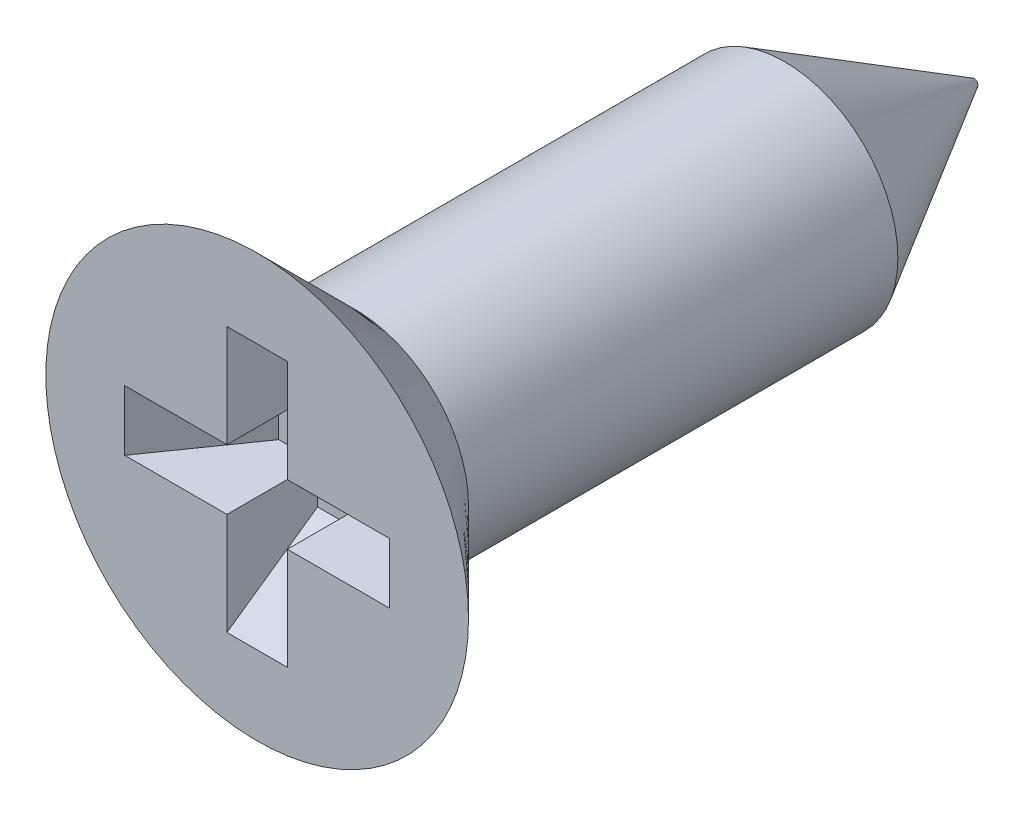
SolidWorks part; units mm, degrees
ref_plane "Plan de face" through (0, 0, 0) normal (0, 0, 1) x (1, 0, 0)
ref_plane "Plan de dessus" through (0, 0, 0) normal (0, 1, 0) x (1, 0, 0)
ref_plane "Plan de droite" through (0, 0, 0) normal (1, 0, 0) x (0, 0, -1)
sketch "Esquisse1" plane through (0, 0, 0) normal (1, 0, 0) x (0, 0, -1)
  line L0 (-1.6035, 0) -> (7.1529, 0) construction
  line L1 (0, 5.0438) -> (0, -4.594) construction
  line L2 (0, 2.8) -> (1.3, 1.5)
  line L3 (1.3, 1.5) -> (1.3, 0)
  line L4 (-1.442, 2.8) -> (2.7621, 2.8) construction
  line L5 (0, 2.8) -> (8.0274, -5.2274) construction
  line L6 (-1.0988, 1.5) -> (4.1029, 1.5) construction
  line L7 (1.3, 0) -> (0, 0)
  line L9 (0, 2.8) -> (0, 0)
revolve "Révolution2" add sketch "Esquisse1" angle 360 about L0
sketch "Esquisse3" plane through (0, 0, 0) normal (0, 0, 1) x (1, 0, 0)
  circle A0 centre (0, 0) radius 1.5
extrude "Extrusion1" add sketch "Esquisse3" against normal blind 9.5
sketch "Esquisse2" plane through (0, 0, 0) normal (0, 0, 1) x (1, 0, 0)
  line L0 (0.4, -0.4) -> (1.755, -0.4)
  line L1 (0.4, 0.4) -> (1.755, 0.4)
  line L2 (-1.755, -0.4) -> (-0.4, -0.4)
  line L3 (-0.4, 1.755) -> (-0.4, 0.4)
  line L4 (-1.755, 0.4) -> (-0.4, 0.4)
  line L5 (0.4, 1.755) -> (0.4, 0.4)
  line L6 (-0.4, 1.755) -> (0.4, 1.755)
  line L7 (1.755, 0.4) -> (1.755, -0.4)
  line L8 (0.4, -1.755) -> (-0.4, -1.755)
  line L9 (-1.755, -0.4) -> (-1.755, 0.4)
  line L10 (-0.4, -0.4) -> (-0.4, -1.755)
  line L12 (0.4, -0.4) -> (0.4, -1.755)
  circle A0 centre (0, 0) radius 1.8 construction
extrude "Enlèv. mat.-Extru.2" cut sketch "Esquisse2" against normal blind 1.2
draft "Dépouille3" type of draft neutral plane draft angle 35 faces to draft 4 parameters "D1"=35
chamfer "Chanfrein1" distance 1.45 angle 60 1 edges at (1.5, 0, -9.5)
sketch "Esquisse4" plane through (0, 0, -1.2) normal (0, 0, 1) x (1, 0, 0)
  text T0 "www.a4.fr" font "Arial" height 0.01
extrude "Enlèv. mat.-Extru.3" cut sketch "Esquisse4" against normal blind 0.01
